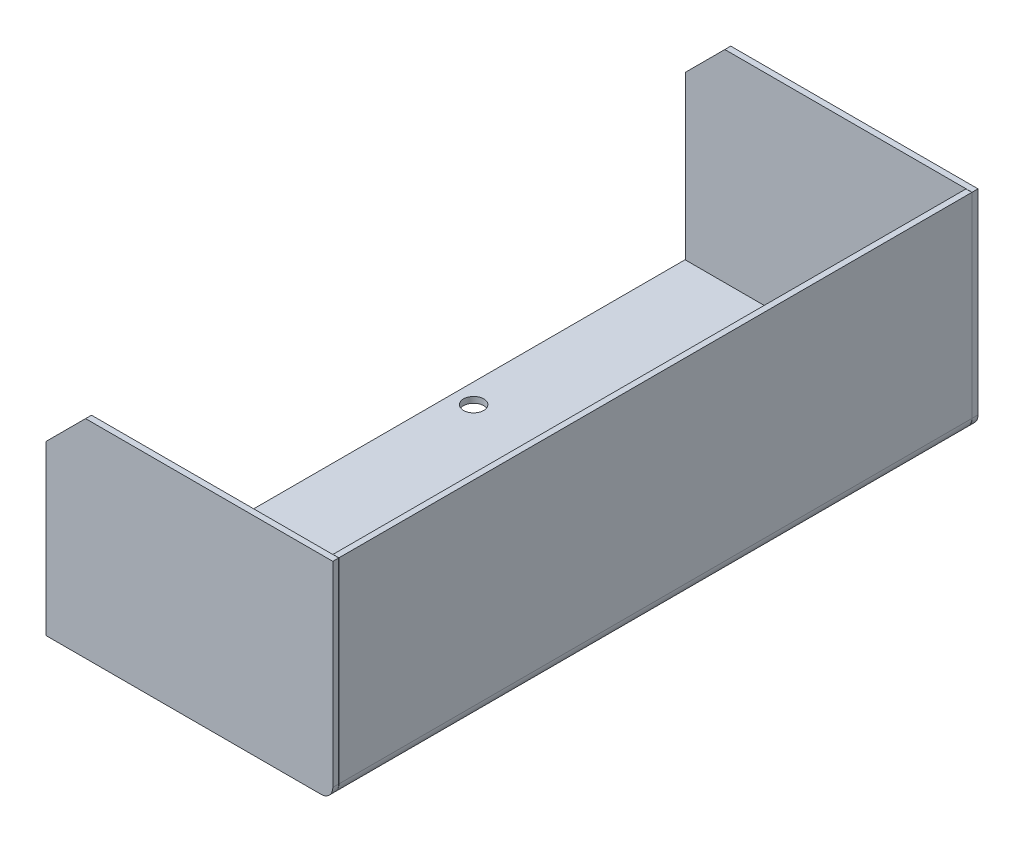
SolidWorks part; units mm, degrees
ref_plane "Plan de face" through (0, 0, 0) normal (0, 0, 1) x (1, 0, 0)
ref_plane "Plan de dessus" through (0, 0, 0) normal (0, 1, 0) x (1, 0, 0)
ref_plane "Plan de droite" through (0, 0, 0) normal (1, 0, 0) x (0, 0, -1)
sketch "Esquisse1" plane through (0, 0, 0) normal (0, 0, 1) x (1, 0, 0)
  line L0 (-41.1334, 0) -> (65.8344, 0) construction
  line L1 (-143.5, -1.5) -> (-4.5, -1.5)
  line L2 (-143.5, -1.5) -> (-143.5, 1.5)
  line L3 (-143.5, 1.5) -> (-4.5, 1.5)
  line L4 (-1.5, 103.5) -> (-1.5, 4.5)
  line L5 (1.5, 103.5) -> (-1.5, 103.5)
  line L6 (1.5, 103.5) -> (1.5, 4.5)
  line L7 (0, 54.8445) -> (0, -41.2381) construction
  arc A0 (-1.5, 4.5) -> (-4.5, 1.5) centre (-4.5, 4.5) cw
  arc A1 (1.5, 4.5) -> (-4.5, -1.5) centre (-4.5, 4.5) cw
  point P15 (1.5, -1.5)
  dimension "D4" = 3
  dimension "D5" = 6
  dimension "D1" = 145
  dimension "D2" = 105
  dimension "D3" = 3
extrude "Extrusion1" add sketch "Esquisse1" along normal blind 320
ref_plane "Plan1" through (0, 0, -0.1) normal (0, 0, -1) x (-1, 0, 0)
sketch "Esquisse2" plane through (0, 0, -0.1) normal (0, 0, -1) x (-1, 0, 0)
  line L0 (143.5, -1.5) -> (4.5, -1.5) construction
  line L1 (-1.5, 103.5) -> (143.5, 103.5)
  line L2 (-1.5, 103.5) -> (-1.5, 4.5)
  line L3 (4.5, -1.5) -> (143.5, -1.5)
  line L4 (143.5, 103.5) -> (143.5, -1.5)
  line L5 (-1.5, 4.5) -> (-1.5, 103.5) construction
  line L6 (143.5, 1.5) -> (143.5, -1.5) construction
  line L7 (-1.5, 103.5) -> (1.5, 103.5) construction
  arc A0 (-1.5, 4.5) -> (4.5, -1.5) centre (4.5, 4.5) ccw
  dimension "D1" = 6
extrude "Extrusion2" add sketch "Esquisse2" along normal blind 3
ref_plane "Plan2" through (0, 0, 320.1) normal (0, 0, 1) x (1, 0, 0)
sketch "Esquisse3" plane through (0, 0, 320.1) normal (0, 0, 1) x (1, 0, 0)
  line L1 (1.5, 4.5) -> (1.5, 103.5) construction
  line L2 (-143.5, -1.5) -> (-143.5, 103.5) construction
  line L3 (-143.5, 103.5) -> (1.5, 103.5) construction
  line L4 (-4.5, -1.5) -> (-143.5, -1.5)
  line L5 (1.5, 4.5) -> (1.5, 103.5)
  line L6 (-143.5, -1.5) -> (-143.5, 103.5)
  line L7 (-143.5, 103.5) -> (1.5, 103.5)
  arc A0 (1.5, 4.5) -> (-4.5, -1.5) centre (-4.5, 4.5) cw
extrude "Extrusion3" add sketch "Esquisse3" along normal blind 3
sketch "Esquisse4" plane through (0, -1.5, 0) normal (0, -1, 0) x (1, 0, 0)
  line L0 (-4.5, -3.1) -> (-143.5, -3.1) construction
  line L1 (1.5, 320) -> (1.5, 0) construction
  line L2 (-143.5, 320) -> (-143.5, 0) construction
  circle A0 centre (-101, 266.9) radius 4.1
  circle A1 centre (-133.5, 116.9) radius 5.1
  circle A2 centre (-61, 13.9) radius 4.1
  dimension "D1" = 8.2
  dimension "D2" = 10.2
  dimension "D3" = 17
  dimension "D4" = 62.5
  dimension "D5" = 40
  dimension "D6" = 253
  dimension "D7" = 120
  dimension "D8" = 10
extrude "Enlèv. mat.-Extru.1" cut sketch "Esquisse4" against normal up to next (3 mm away)
chamfer "Chanfrein1" distance 20 angle 45 1 edges at (-143.5, 103.5, -1.6)
chamfer "Chanfrein2" distance 20 angle 45 1 edges at (-143.5, 103.5, 321.6)
